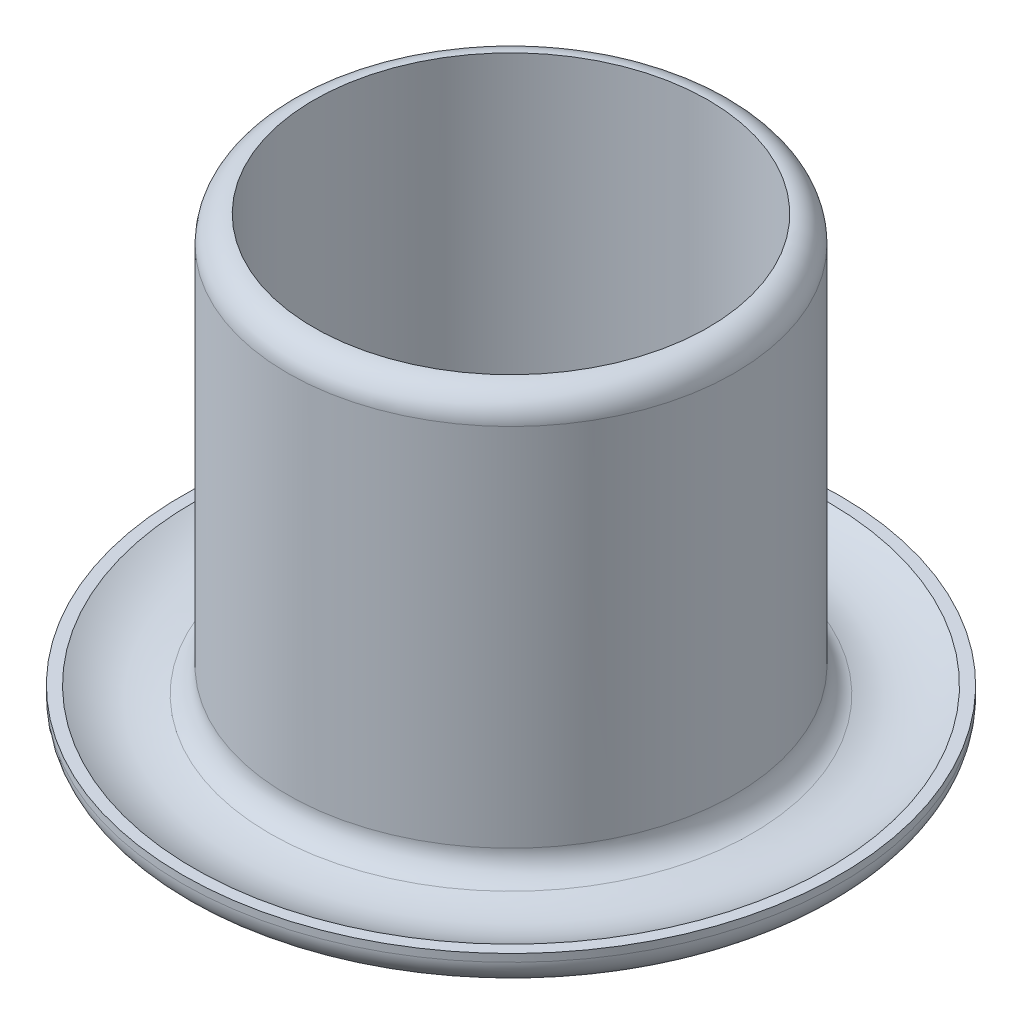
SolidWorks part; units mm, degrees
ref_plane "Front Plane" through (0, 0, 0) normal (0, 0, 1) x (1, 0, 0)
ref_plane "Top Plane" through (0, 0, 0) normal (0, 1, 0) x (1, 0, 0)
ref_plane "Right Plane" through (0, 0, 0) normal (1, 0, 0) x (0, 0, -1)
sketch "Sketch2" plane through (0, 0, 0) normal (0, 0, 1) x (1, 0, 0)
  line L0 (1.5, 0) -> (2.5, 0) construction
  line L1 (2.5, 0) -> (2.5, 0.2)
  line L2 (2.5, 0.2) -> (2.413, 0.2)
  line L3 (1.7, 0.2) -> (1.7, 3.3064)
  line L4 (1.7, 3.3064) -> (1.5, 3.3064)
  line L5 (1.5, 3.3064) -> (1.5, 0)
  line L6 (0, 0) -> (0, 3.3064) construction
  spline S0 degree 2 poles (1.7, 0.2) (2.0557, 0) (2.413, 0.2) knots 0 0 0 1 1 1
  spline S1 degree 2 poles (1.5, 0) (2.004, -0.2019) (2.5, 0) knots 0 0 0 1 1 1
  point P10 (0, -0.0964)
  dimension "D4" = 0.1
  dimension "D5" = 0.1
  dimension "D1" = 1
  dimension "D2" = 1.5
  dimension "D3" = 0.2
revolve "Revolve1" add sketch "Sketch2" angle 360 about L6
fillet "Fillet1" radius 0.2 4 edges at (0, 0, -2.5) (0, 0, -1.5) (0, 0.2, -1.7) (0, 3.3064, -1.7)
